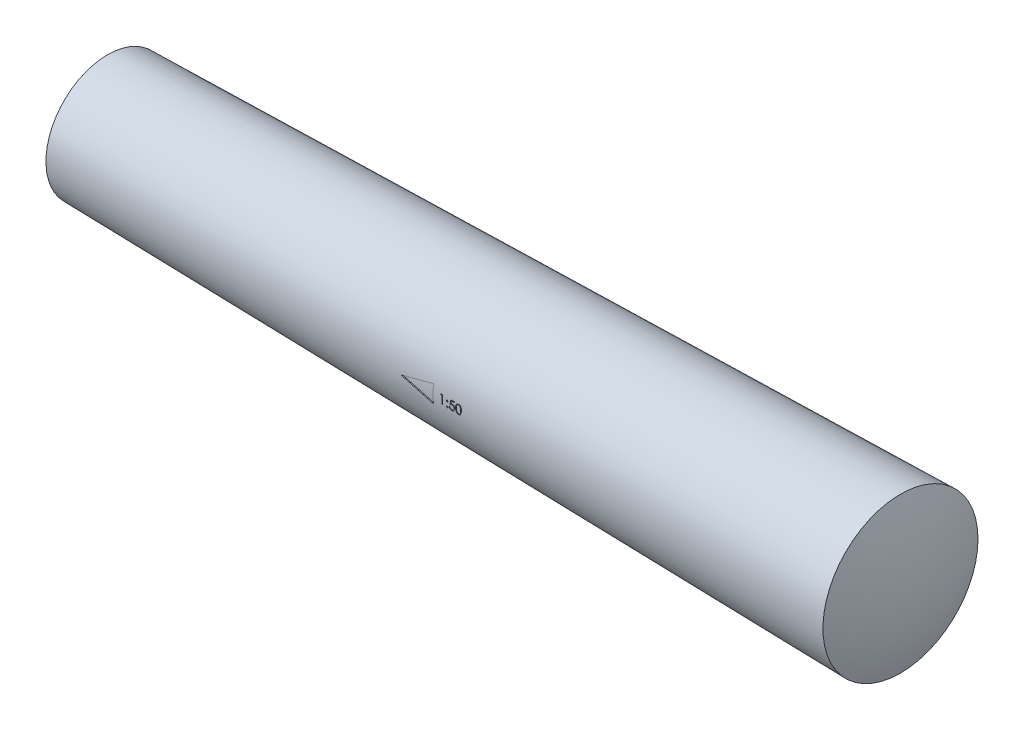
SolidWorks part; units mm, degrees
ref_plane "Front Plane" through (0, 0, 0) normal (0, 0, 1) x (1, 0, 0)
ref_plane "Top Plane" through (0, 0, 0) normal (0, 1, 0) x (1, 0, 0)
ref_plane "Right Plane" through (0, 0, 0) normal (1, 0, 0) x (0, 0, -1)
sketch "Sketch1" plane through (0, 0, 0) normal (1, 0, 0) x (0, 0, -1)
  circle A0 centre (0, 0) radius 7
  dimension "D1" = 14
extrude "Extrude1" add sketch "Sketch1" along normal mid plane 90
draft "Draft1" type of draft neutral plane draft angle 1.146 faces to draft 1 parameters "D1"=1.146
sketch "Sketch2" plane through (0, 0, 0) normal (0, 0, 1) x (1, 0, 0)
  line L0 (-45, 0) -> (-45, 7)
  line L1 (-45, 7) -> (-45, -7) construction
  line L2 (-45, 0) -> (-46.6, 0)
  line L3 (-46.6, 0) -> (-46.6, -7.9) construction
  line L4 (45, 0) -> (45, 8.8001)
  line L5 (45, -8.8001) -> (45, 8.8001) construction
  line L6 (45, 0) -> (46.6, 0)
  line L7 (46.6, 0) -> (46.6, -7.9) construction
  line L8 (-45, -7) -> (45, -8.8001) construction
  arc A0 (-46.6, 0) -> (-45, 7) centre (-30.4875, 0) cw
  arc A1 (46.6, 0) -> (45, 8.8001) centre (21.5997, 0) ccw
  point P14 (0, -7.9)
revolve "Revolve1" add sketch "Sketch2" angle 360 about L2
sketch "Sketch5" plane through (0, 0, 0) normal (0, 0, 1) x (1, 0, 0)
  line L0 (0, 7.9) -> (0, -7.9) construction
  line L1 (45, 8.8001) -> (-45, 7) construction
  line L2 (-45, -7) -> (45, -8.8001) construction
ref_plane "Plane2" through (0, 0, 0) normal (-0.02, 0, 0.9998) x (0.9998, 0, 0.02)
sketch "Sketch6" plane through (0, 0, 0) normal (-0.02, 0, 0.9998) x (0.9998, 0, 0.02)
  line L0 (0, 0) -> (0, 1)
  line L1 (0, 7.9) -> (0, -7.9) construction
  line L2 (0, 1) -> (-3.7321, 0)
  line L3 (-3.7321, 0) -> (0, -1)
  line L4 (0, -1) -> (0, 0)
  line L5 (0, -0.5) -> (4, -0.5) construction
  text T0 "1:50" font "Century Gothic" height 1
  dimension "D1" = 2
  dimension "D2" = 30
  dimension "D3" = 4
wrap "Wrap2" sketch "Sketch6" wrap type deboss source sketch "Sketch6" thickness 0.1 parameters "D1"=0.1
equation "\"D2@Sketch2\" = \"D1@Sketch2\""
